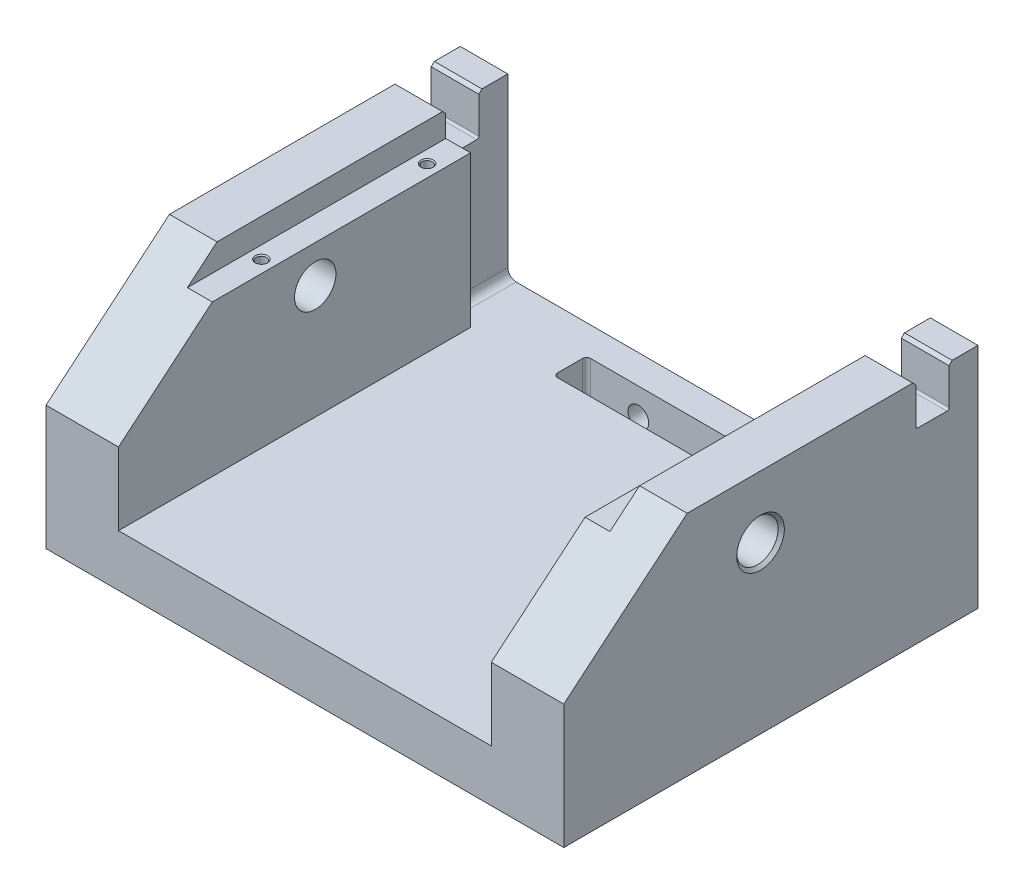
SolidWorks part; units mm, degrees
ref_plane "Front" through (0, 0, 0) normal (0, 0, 1) x (1, 0, 0)
ref_plane "Top" through (0, 0, 0) normal (0, 1, 0) x (1, 0, 0)
ref_plane "Right" through (0, 0, 0) normal (1, 0, 0) x (0, 0, -1)
sketch "Sketch1" plane through (0, 0, 0) normal (0, 0, 1) x (1, 0, 0)
  line L0 (-90, 110) -> (-90, 25)
  line L1 (-90, 25) -> (90, 25)
  line L2 (90, 25) -> (90, 110)
  line L3 (90, 110) -> (125, 110)
  line L4 (125, 110) -> (125, 0)
  line L5 (125, 0) -> (-125, 0)
  line L6 (-125, 0) -> (-125, 110)
  line L7 (-125, 110) -> (-90, 110)
  dimension "D1" = 25
  dimension "D2" = 110
  dimension "D3" = 250
  dimension "D4" = 180
extrude "Boss-Extrude1" add sketch "Sketch1" along normal mid plane 200
sketch "Sketch2" plane through (0, 0, 0) normal (1, 0, 0) x (0, 0, -1)
  line L0 (-100, 60) -> (-40.4123, 110)
  line L1 (-100, 0) -> (-100, 110) construction
  line L2 (-100, 110) -> (100, 110) construction
  line L3 (-100, 0) -> (100, 0) construction
  dimension "D1" = 60
  dimension "D2" = 50
extrude "Cut-Extrude2" cut sketch "Sketch2" against normal through all both and the other way through all
sketch "Sketch3" plane through (0, 0, 0) normal (0, 0, 1) x (1, 0, 0)
  line L0 (0, 0) -> (0, 107.6677) construction
  line L1 (-102, 110) -> (-102, 98)
  line L2 (90, 110) -> (102, 110)
  line L3 (90, 110) -> (90, 98)
  line L4 (90, 98) -> (102, 98)
  line L5 (102, 110) -> (102, 98)
  line L6 (-90, 98) -> (-102, 98)
  line L7 (-90, 110) -> (-90, 98)
  line L8 (-90, 110) -> (-102, 110)
  dimension "D1" = 12
  dimension "D2" = 12
extrude "Cut-Extrude3" cut sketch "Sketch3" against normal through all both and the other way through all
sketch "Sketch4" plane through (0, 110, 0) normal (0, 1, 0) x (1, 0, 0)
  line L0 (-102, 100) -> (-102, -40.4123) construction
  line L1 (-90, 100) -> (-102, 100)
  line L2 (-90, 100) -> (-90, 70)
  line L3 (-90, 70) -> (-102, 70)
  line L4 (-102, 100) -> (-102, 70)
  line L5 (0, 0) -> (0, 100) construction
  line L6 (90, 100) -> (-90, 100) construction
  line L7 (102, 100) -> (102, 70)
  line L8 (90, 70) -> (102, 70)
  line L9 (90, 100) -> (90, 70)
  line L10 (90, 100) -> (102, 100)
  dimension "D1" = 30
extrude "Cut-Extrude4" cut sketch "Sketch4" against normal up to surface (85 mm away)
sketch "Sketch5" plane through (0, 110, 0) normal (0, 1, 0) x (1, 0, 0)
  line L0 (-125, -40.4123) -> (-125, 100) construction
  line L1 (-102, 70) -> (-125, 70)
  line L2 (-102, 70) -> (-102, 86)
  line L3 (-102, 86) -> (-125, 86)
  line L4 (-125, 70) -> (-125, 86)
  line L5 (0, 0) -> (0, 100) construction
  line L6 (102, 100) -> (-102, 100) construction
  line L7 (125, 70) -> (125, 86)
  line L8 (102, 86) -> (125, 86)
  line L9 (102, 70) -> (102, 86)
  line L10 (102, 70) -> (125, 70)
  dimension "D1" = 16
extrude "Cut-Extrude5" cut sketch "Sketch5" against normal blind 20
sketch "Sketch6" plane through (0, 25, 0) normal (0, 1, 0) x (1, 0, 0)
  line L0 (0, 0) -> (0, 70) construction
  line L1 (-50, 86) -> (50, 86)
  line L2 (-50, 86) -> (-50, 70)
  line L3 (-50, 70) -> (50, 70)
  line L4 (50, 86) -> (50, 70)
  line L5 (-125, 70) -> (-102, 70) construction
  line L6 (-102, 86) -> (-125, 86) construction
  dimension "D1" = 100
extrude "Cut-Extrude6" cut sketch "Sketch6" against normal through all
sketch "Sketch8" plane through (0, 98, 0) normal (0, 1, 0) x (1, 0, 0)
  line L0 (-90, 70) -> (-90, -54.7134) construction
  line L1 (-96, 55) -> (96, 55) construction
  line L2 (-96, 55) -> (-96, -25) construction
  line L3 (-96, -25) -> (96, -25) construction
  line L4 (96, 55) -> (96, -25) construction
  line L5 (-102, 70) -> (-90, 70) construction
  line L6 (0, 0) -> (0, 55) construction
  circle A0 centre (-96, 55) radius 2.5
  circle A1 centre (-96, -25) radius 2.5
  circle A2 centre (96, 55) radius 2.5
  circle A3 centre (96, -25) radius 2.5
  dimension "D1" = 5
  dimension "D2" = 6
  dimension "D3" = 15
  dimension "D4" = 80
extrude "Cut-Extrude7" cut sketch "Sketch8" against normal blind 15
chamfer "Chamfer1" distance 0.5 angle 45 4 edges at (96, 98, 27.5) (96, 98, -52.5) (-96, 98, 27.5) (-96, 98, -52.5)
sketch "Sketch9" plane through (0, 0, -100) normal (0, 0, -1) x (-1, 0, 0)
  line L0 (-25, 12) -> (25, 12) construction
  line L1 (0, 0) -> (0, 12) construction
  circle A0 centre (-25, 12) radius 5
  circle A1 centre (25, 12) radius 5
  dimension "D3" = 10
  dimension "D1" = 12
  dimension "D2" = 50
extrude "Cut-Extrude8" cut sketch "Sketch9" against normal blind 40
fillet "Fillet1" radius 1 4 edges at (113.5, 90, -70) (113.5, 90, -86) (-113.5, 90, -70) (-113.5, 90, -86)
fillet "Fillet2" radius 2 4 edges at (50, 12.5, -70) (-50, 12.5, -70) (-50, 12.5, -86) (50, 12.5, -86)
fillet "Fillet3" radius 4 2 edges at (-102, 25, -85) (102, 25, -85)
sketch "Sketch10" plane through (0, 0, 0) normal (1, 0, 0) x (0, 0, -1)
  line L0 (-40.4123, 110) -> (70, 110) construction
  line L1 (-100, 0) -> (-100, 60) construction
  circle A0 centre (-5, 80) radius 10
  dimension "D1" = 20
  dimension "D2" = 30
  dimension "D3" = 95
extrude "Cut-Extrude9" cut sketch "Sketch10" against normal through all both and the other way through all
chamfer "Chamfer2" distance 1.5 angle 45 4 edges at (113.5, 110, -86) (113.5, 110, -70) (-113.5, 110, -70) (-113.5, 110, -86)
chamfer "Chamfer3" distance 1.5 angle 45 2 edges at (-125, 80, -5) (125, 80, -5)
